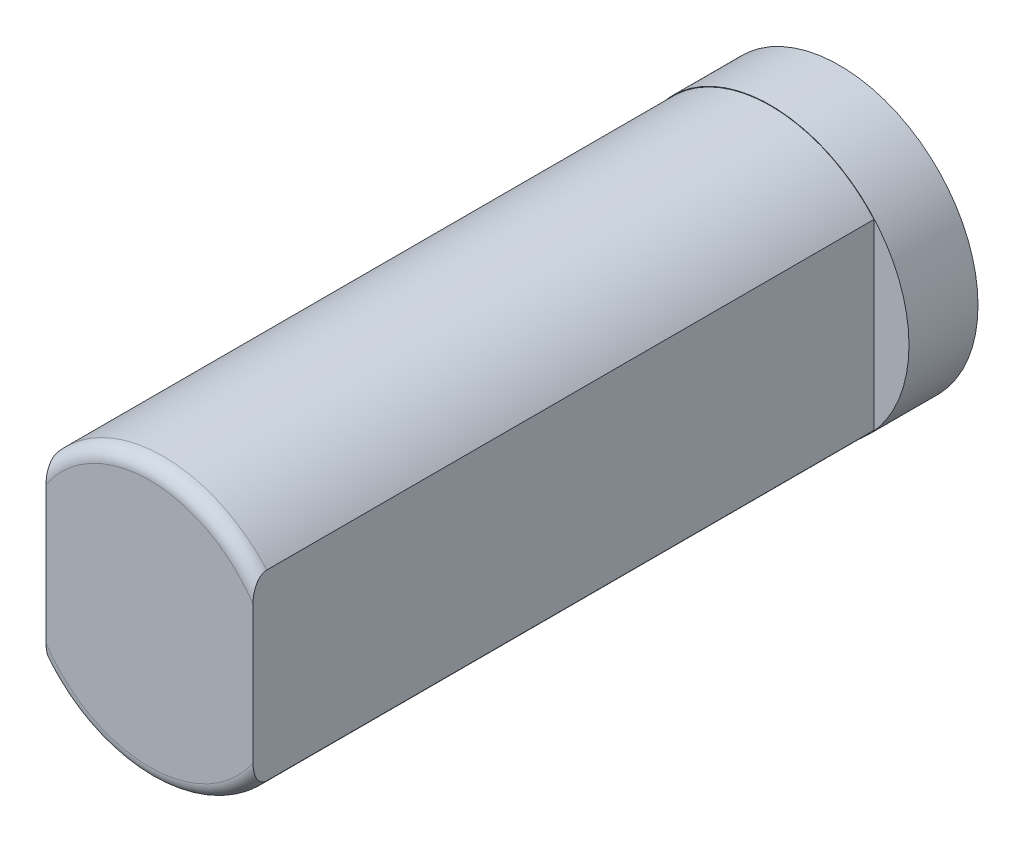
SolidWorks part; units mm, degrees
ref_plane "Front Plane" through (0, 0, 0) normal (0, 0, 1) x (1, 0, 0)
ref_plane "Top Plane" through (0, 0, 0) normal (0, 1, 0) x (1, 0, 0)
ref_plane "Right Plane" through (0, 0, 0) normal (1, 0, 0) x (0, 0, -1)
sketch "Sketch1" plane through (0, 0, 0) normal (0, 0, 1) x (1, 0, 0)
  line L0 (0, 2) -> (0, -2) construction
  line L2 (-1.5, 1.3229) -> (-1.5, -1.3229)
  line L4 (1.5, 1.3229) -> (1.5, -1.3229)
  arc A0 (1.5, 1.3229) -> (-1.5, 1.3229) centre (0, 0) ccw
  arc A1 (-1.5, -1.3229) -> (1.5, -1.3229) centre (0, 0) ccw
  dimension "D1" = 4
extrude "Boss-Extrude1" add sketch "Sketch1" along normal blind 10
fillet "Fillet1" radius 0.2 2 edges at (0, -2, 10) (0, 2, 10)
sketch "Sketch2" plane through (0, 0, 0) normal (0, 0, -1) x (-1, 0, 0)
  circle A0 centre (0, 0) radius 2.0072
extrude "Boss-Extrude2" add sketch "Sketch2" against normal blind 1
